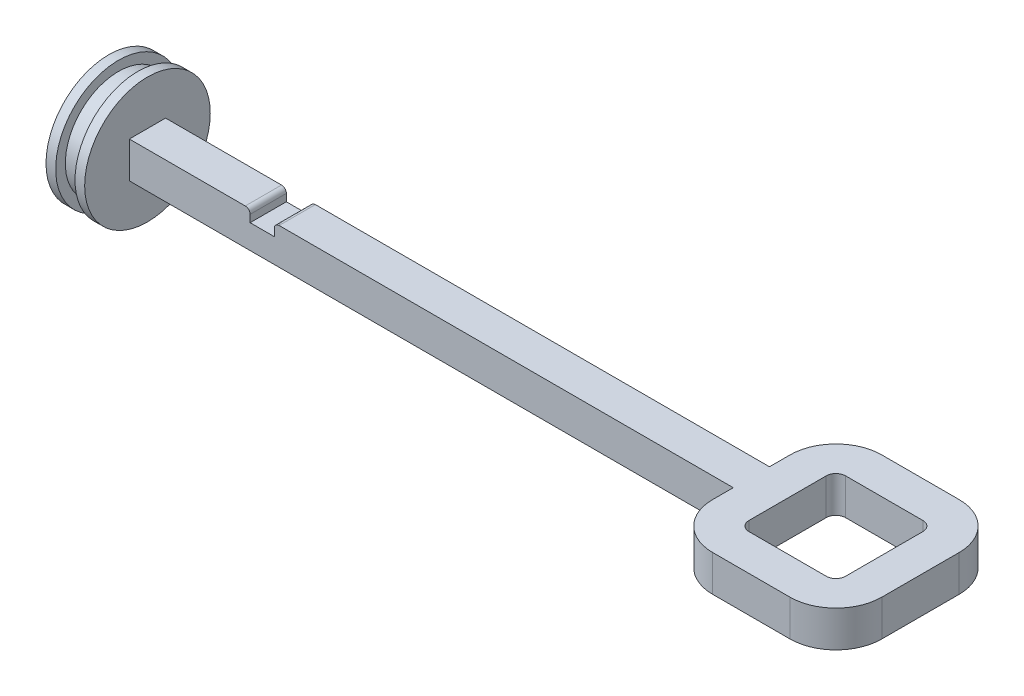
SolidWorks part; units mm, degrees
ref_plane "Front Plane" through (0, 0, 0) normal (0, 0, 1) x (1, 0, 0)
ref_plane "Top Plane" through (0, 0, 0) normal (0, 1, 0) x (1, 0, 0)
ref_plane "Right Plane" through (0, 0, 0) normal (1, 0, 0) x (0, 0, -1)
sketch "Sketch1" plane through (0, 0, 0) normal (0, 1, 0) x (1, 0, 0)
  line L0 (0, 3.75) -> (0, -3.75) construction
  line L1 (-62.5, 3.75) -> (62.5, 3.75)
  line L2 (-62.5, -3.75) -> (62.5, -3.75)
  line L3 (-62.5, 3.75) -> (-62.5, -3.75)
  line L6 (70, 10) -> (70, -10)
  line L7 (70, 10) -> (90, 10)
  line L8 (90, 10) -> (90, -10)
  line L9 (90, -10) -> (70, -10)
  line L10 (62.5, 17.5) -> (97.5, 17.5)
  line L11 (97.5, 17.5) -> (97.5, -17.5)
  line L12 (97.5, -17.5) -> (62.5, -17.5)
  line L13 (62.5, 17.5) -> (62.5, 3.75)
  line L14 (62.5, -3.75) -> (62.5, -17.5)
  line L15 (62.5, 17.5) -> (62.5, -17.5) construction
  point P4 (0, 0)
  point P8 (0, 3.75)
  point P11 (0, -3.75)
  point P16 (70, 0)
  dimension "D1" = 20
  dimension "D3" = 125
  dimension "D4" = 7.5
  dimension "D5" = 7.5
extrude "Boss-Extrude1" add sketch "Sketch1" along normal mid plane 7.5
sketch "Sketch2" plane through (-62.5, 0, 0) normal (-1, 0, 0) x (0, 0, 1)
  circle A0 centre (0, 0) radius 13
  dimension "D1" = 26
extrude "Boss-Extrude2" add sketch "Sketch2" along normal blind 8
sketch "Sketch4" plane through (0, 0, 0) normal (0, 0, 1) x (1, 0, 0)
  line L0 (-70.5, 13) -> (-70.5, -13) construction
  line L3 (-70.5, 13) -> (-62.5, 13) construction
  line L4 (-62.5, -13) -> (-62.5, 13) construction
  line L5 (-66.5, 13) -> (-66.5, 11) construction
  line L6 (-68.5, 11) -> (-64.5, 11)
  line L7 (-68.5, 11) -> (-68.5, 13)
  line L8 (-68.5, 13) -> (-64.5, 13)
  line L9 (-64.5, 13) -> (-64.5, 11)
  line L10 (0, 0) -> (-70.5, 0) construction
  point P13 (-66.5, 11)
  dimension "D1" = 13
  dimension "D2" = 2
  dimension "D3" = 4
revolve "Cut-Revolve1" cut sketch "Sketch4" angle 360 about L10
fillet "Fillet2" radius 9.5 4 edges at (97.5, 0, 17.5) (62.5, 0, 17.5) (97.5, 0, -17.5) (62.5, 0, -17.5)
fillet "Fillet3" radius 2 4 edges at (70, 0, 10) (90, 0, 10) (90, 0, -10) (70, 0, -10)
sketch "Sketch5" plane through (0, 0, 0) normal (0, 0, 1) x (1, 0, 0)
  line L0 (-62.5, 3.75) -> (-37.5, 3.75) construction
  line L1 (-62.5, 3.75) -> (62.5, 3.75) construction
  line L3 (-37.5, 3.75) -> (-32.5, 3.75)
  line L4 (-37.5, 3.75) -> (-37.5, 1.25)
  line L5 (-37.5, 1.25) -> (-32.5, 1.25)
  line L6 (-32.5, 3.75) -> (-32.5, 1.25)
  dimension "D1" = 25
  dimension "D2" = 5
  dimension "D3" = 2.5
extrude "Cut-Extrude1" cut sketch "Sketch5" against normal mid plane 7.5
fillet "Fillet5" radius 1 2 edges at (-32.5, 3.75, 0) (-37.5, 3.75, 0)
